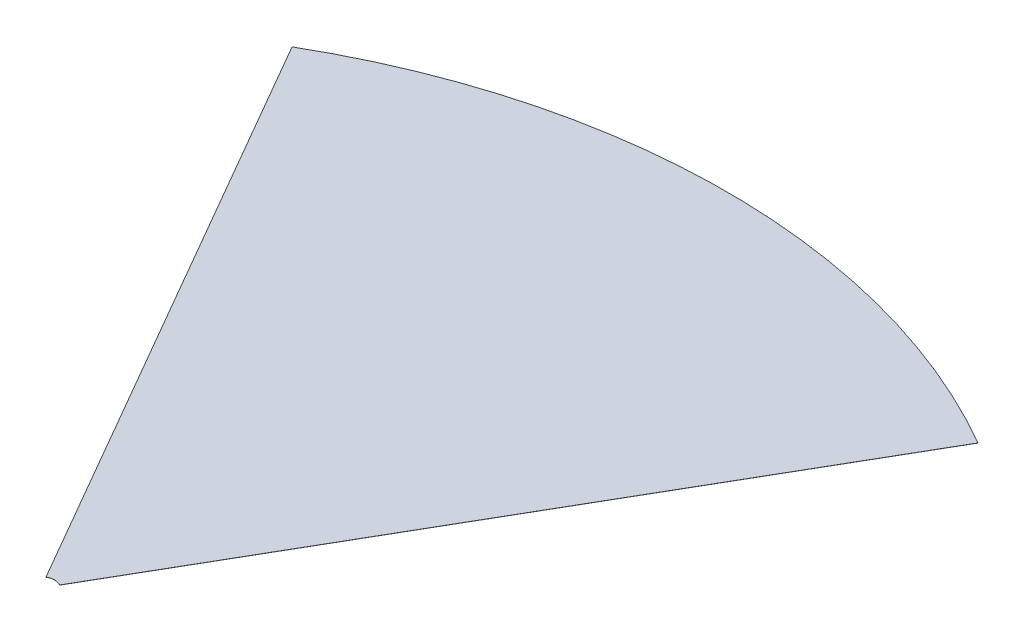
SolidWorks part; units mm, degrees
ref_plane "Front" through (0, 0, 0) normal (0, 0, 1) x (1, 0, 0)
ref_plane "Top" through (0, 0, 0) normal (0, 1, 0) x (1, 0, 0)
ref_plane "Right" through (0, 0, 0) normal (1, 0, 0) x (0, 0, -1)
sketch "Sketch3" plane through (0, 0, 0) normal (0, 1, 0) x (1, 0, 0)
  line L0 (0.5, 0.866) -> (25, 43.3013)
  line L2 (-0.5, 0.866) -> (-25, 43.3013)
  arc A0 (25, 43.3013) -> (-25, 43.3013) centre (0, 0) ccw
  arc A1 (0.5, 0.866) -> (-0.5, 0.866) centre (0, 0) ccw
extrude "Extrude2" add sketch "Sketch3" along normal blind 0.01
